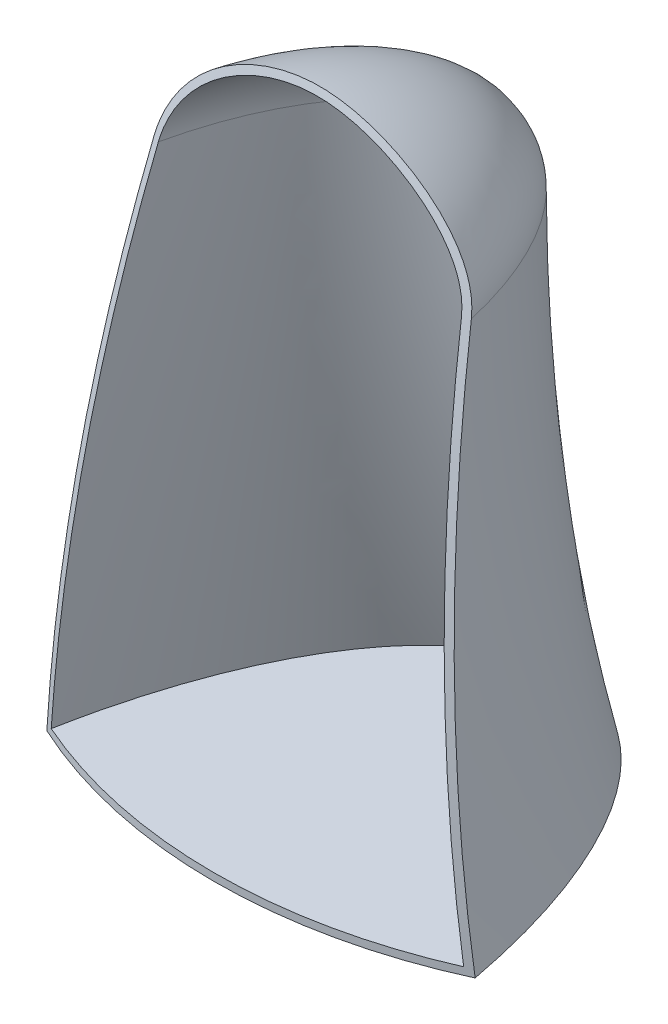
SolidWorks part; units mm, degrees
other "<Speaker_Surface_Master>-<Surface-Extend2>"
other "<Speaker_Surface_Master>-<Surface-Extend1>"
other "<Speaker_Surface_Master>-<Surface-Extend3>"
other "<Speaker_Surface_Master>-<Driver Mounts[2]>"
other "<Speaker_Surface_Master>-<Driver Mounts[1]>"
other "<Speaker_Surface_Master>-<Base>"
ref_plane "Front Plane" through (0, 0, 0) normal (0, 0, 1) x (1, 0, 0)
ref_plane "Top Plane" through (0, 0, 0) normal (0, 1, 0) x (1, 0, 0)
ref_plane "Right Plane" through (0, 0, 0) normal (1, 0, 0) x (0, 0, -1)
inserted part "Speaker_Surface_Master"
delete or keep bodies "Body-Delete/Keep 1" type delete bodies bodies 104 105 107
other "Intersect1"
shell "Shell1" thickness 3.5
